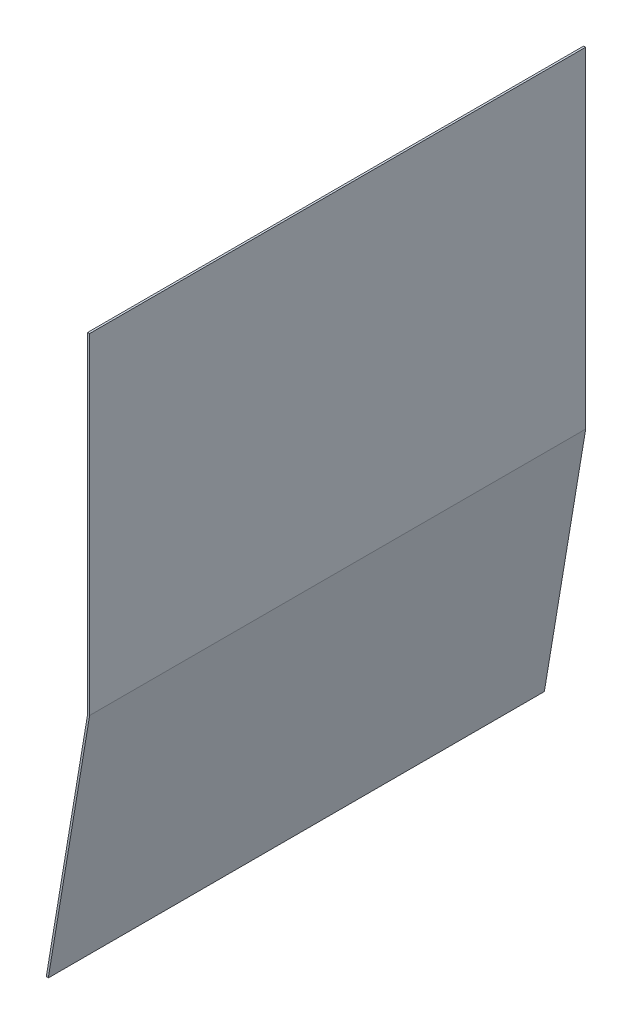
SolidWorks part; units mm, degrees
ref_plane "Front Plane" through (0, 0, 0) normal (0, 0, 1) x (1, 0, 0)
ref_plane "Top Plane" through (0, 0, 0) normal (0, 1, 0) x (1, 0, 0)
ref_plane "Right Plane" through (0, 0, 0) normal (1, 0, 0) x (0, 0, -1)
sketch "Sketch3" plane through (0, 0, 0) normal (0, 0, 1) x (1, 0, 0)
  line L0 (0, 0) -> (0, -200)
  line L1 (0, -200) -> (-25, -350)
  line L2 (-25, -350) -> (0, -350) construction
  line L3 (0, -350) -> (0, -200) construction
  dimension "D1" = 25
  dimension "D2" = 350
  dimension "D3" = 150
extrude "Extrude-Thin1" add sketch "Sketch3" along normal blind 300 thin
